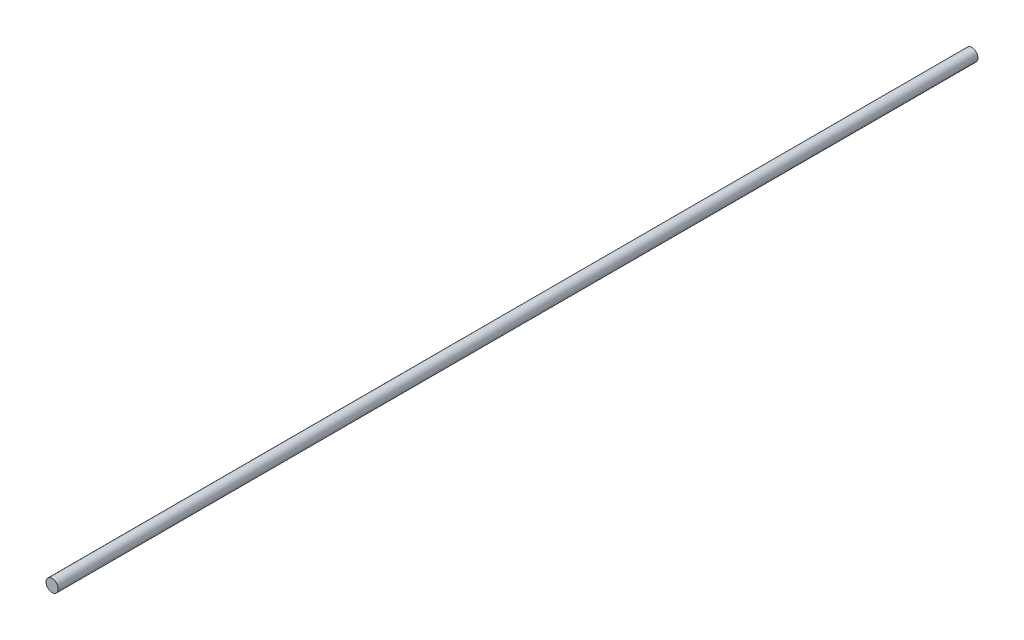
SolidWorks part; units mm, degrees
ref_plane "Front Plane" through (0, 0, 0) normal (0, 0, 1) x (1, 0, 0)
ref_plane "Top Plane" through (0, 0, 0) normal (0, 1, 0) x (1, 0, 0)
ref_plane "Right Plane" through (0, 0, 0) normal (1, 0, 0) x (0, 0, -1)
sketch "Sketch1" plane through (0, 0, 0) normal (0, 0, 1) x (1, 0, 0)
  circle A0 centre (0, 0) radius 30
  dimension "D1" = 60
extrude "Boss-Extrude1" add sketch "Sketch1" against normal blind 4500
